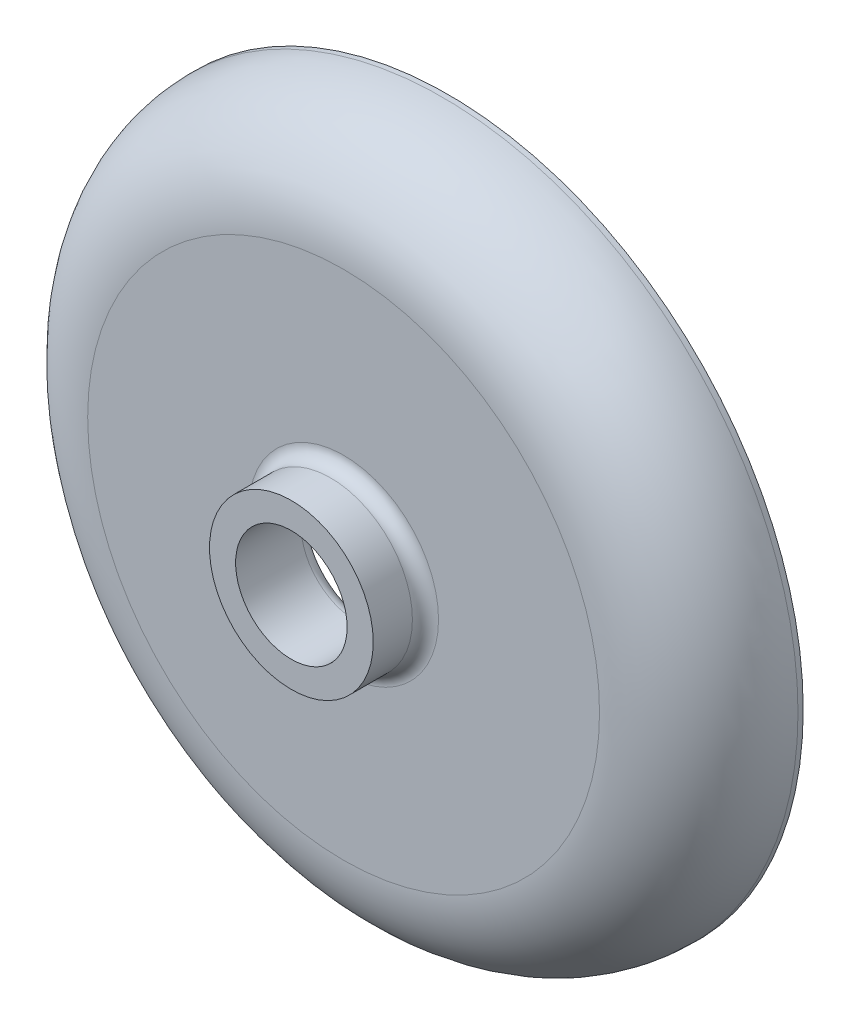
SolidWorks part; units mm, degrees
ref_plane "Plane1" through (0, 0, 0) normal (0, 0, 1) x (1, 0, 0)
ref_plane "Plane2" through (0, 0, 0) normal (0, 1, 0) x (1, 0, 0)
ref_plane "Plane3" through (0, 0, 0) normal (1, 0, 0) x (0, 0, -1)
sketch "Sketch1" plane through (0, 0, 0) normal (0, 0, 1) x (1, 0, 0)
  circle A0 centre (0, 0) radius 13.6
  dimension "D1" = 27.2
extrude "drive shaft plate shape" add sketch "Sketch1" along normal blind 4
fillet "plate main fillet" radius 3.8
sketch "Sketch2" plane through (0, 0, 4) normal (0, 0, 1) x (1, 0, 0)
  circle A0 centre (0, 0) radius 3.135
  dimension "D1" = 6.27
extrude "plate boss" add sketch "Sketch2" along normal blind 2
shell "plate shell" thickness 1
sketch "Sketch3" plane through (0, 0, 6) normal (0, 0, 1) x (1, 0, 0)
  circle A0 centre (0, 0) radius 2.135
  dimension "D1" = 4.27
extrude "drive plate hole" cut sketch "Sketch3" against normal up to next
fillet "drive plate secondary fillet" radius 0.5
